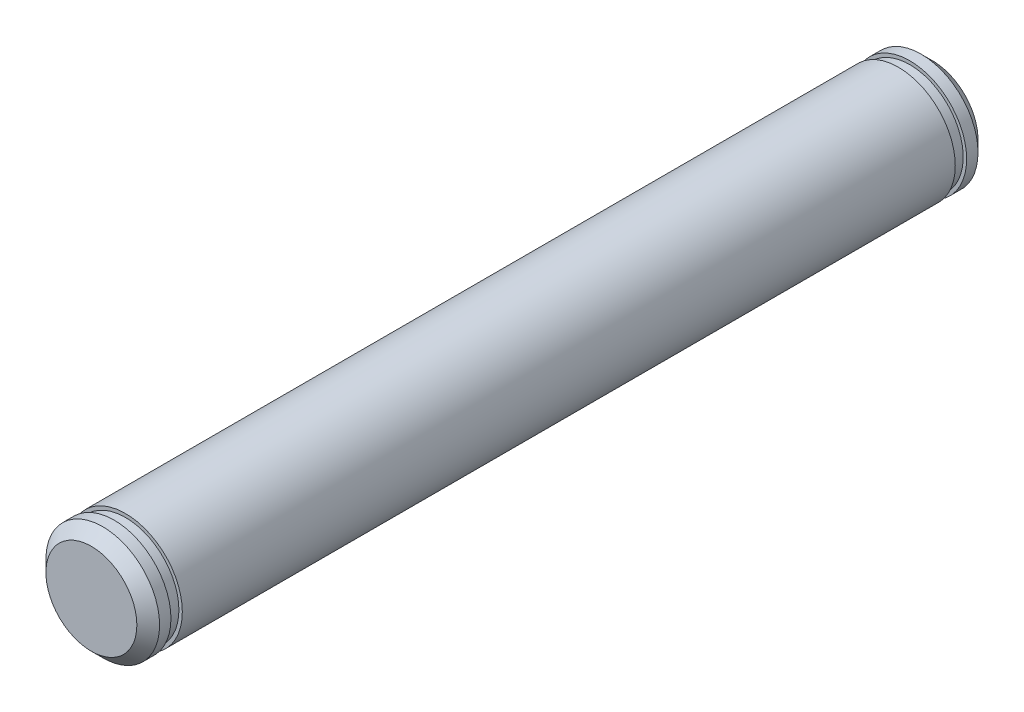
SolidWorks part; units mm, degrees
ref_plane "Plan de face" through (0, 0, 0) normal (0, 0, 1) x (1, 0, 0)
ref_plane "Plan de dessus" through (0, 0, 0) normal (0, 1, 0) x (1, 0, 0)
ref_plane "Plan de droite" through (0, 0, 0) normal (1, 0, 0) x (0, 0, -1)
sketch "Esquisse1" plane through (0, 0, 0) normal (0, 0, 1) x (1, 0, 0)
  circle A0 centre (0, 0) radius 5
  dimension "D1" = 10
extrude "Extrusion1" add sketch "Esquisse1" along normal blind 34
sketch "Esquisse2" plane through (0, 0, 34) normal (0, 0, 1) x (1, 0, 0)
  circle A0 centre (0, 0) radius 4.7
  dimension "D1" = 9.4
extrude "Extrusion2" add sketch "Esquisse2" along normal blind 1
sketch "Esquisse3" plane through (0, 0, 35) normal (0, 0, 1) x (1, 0, 0)
  circle A0 centre (0, 0) radius 5 construction
  circle A1 centre (0, 0) radius 5
extrude "Extrusion3" add sketch "Esquisse3" along normal blind 2
chamfer "Chanfrein1" distance 1 angle 45 1 edges at (5, 0, 37)
mirror "Symétrie1" about plane through (0, 0, 0) normal (0, 0, 1) of "Chanfrein1", "Extrusion3", "Extrusion2", "Extrusion1"
